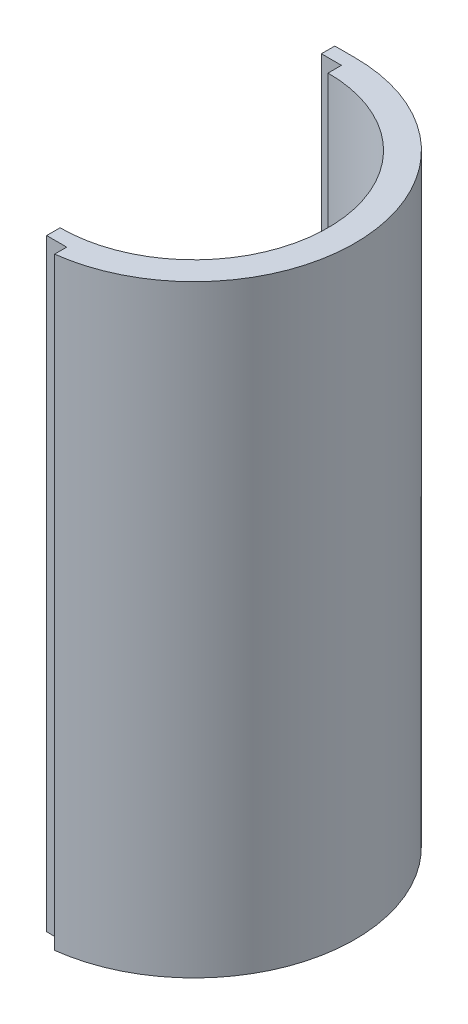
SolidWorks part; units mm, degrees
ref_plane "Front Plane" through (0, 0, 0) normal (0, 0, 1) x (1, 0, 0)
ref_plane "Top Plane" through (0, 0, 0) normal (0, 1, 0) x (1, 0, 0)
ref_plane "Right Plane" through (0, 0, 0) normal (1, 0, 0) x (0, 0, -1)
sketch "Sketch1" plane through (0, 0, 0) normal (0, 1, 0) x (1, 0, 0)
  line L0 (0, 0) -> (0, 12) construction
  line L1 (0, 10) -> (0, 12)
  line L2 (0, -10) -> (0, -12)
  circle A0 centre (0, 0) radius 10 construction
  circle A1 centre (0, 0) radius 12 construction
  arc A2 (0, 10) -> (0, -10) centre (0, 0) cw
  arc A3 (0, -12) -> (0, 12) centre (0, 0) ccw
  dimension "D1" = 2
extrude "Boss-Extrude1" add sketch "Sketch1" along normal blind 45
sketch "Sketch2" plane through (0, 0, 0) normal (0, 1, 0) x (1, 0, 0)
  line L5 (0, -10) -> (0, -12) construction
  line L6 (0, -11) -> (1.4995, -11)
  line L7 (0, -11) -> (0, -13.7511)
  line L8 (0, -13.7511) -> (1.4995, -13.7511)
  line L9 (1.4995, -11) -> (1.4995, -13.7511)
extrude "Cut-Extrude1" cut sketch "Sketch2" along normal blind 60
sketch "Sketch3" plane through (0, 0, 0) normal (0, 1, 0) x (1, 0, 0)
  line L0 (0, 11) -> (-1.4966, 11)
  line L1 (0, 11) -> (0, 12)
  line L2 (0, 12) -> (-1.4966, 12)
  line L3 (-1.4966, 11) -> (-1.4966, 12)
extrude "Boss-Extrude2" add sketch "Sketch3" along normal up to surface (45 mm away)
